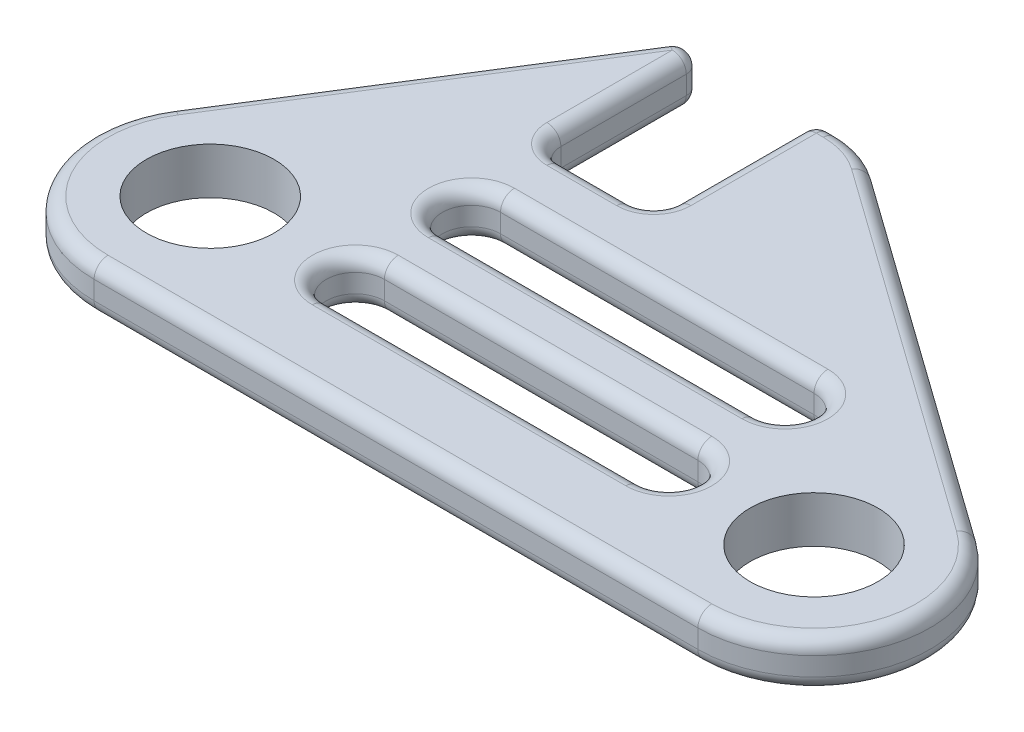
SolidWorks part; units mm, degrees
ref_plane "Plan de face" through (0, 0, 0) normal (0, 0, 1) x (1, 0, 0)
ref_plane "Plan de dessus" through (0, 0, 0) normal (0, 1, 0) x (1, 0, 0)
ref_plane "Plan de droite" through (0, 0, 0) normal (1, 0, 0) x (0, 0, -1)
sketch "Esquisse1" plane through (0, 0, 0) normal (0, 1, 0) x (1, 0, 0)
  line L0 (-7.5868, 0) -> (21.53, 0) construction
  line L1 (0, -3.1577) -> (0, 16.3478) construction
  line L2 (13, 12.5899) -> (13, -3.1577) construction
  line L3 (21.53, -5) -> (-21.6233, -5) construction
  line L5 (-23.019, 9) -> (1.8242, 9) construction
  line L6 (-7.9, 19.837) -> (-7.9, 6.671) construction
  line L7 (-2.9, 19.837) -> (-2.9, 6.671) construction
  line L8 (-18, -7.658) -> (-18, 19.837) construction
  line L9 (0.1379, 15.3161) -> (15.9035, 4.0706)
  line L10 (-9.0077, 15.7198) -> (-17.2307, 2.6648)
  line L11 (13, -5) -> (-13, -5)
  line L12 (-2.9, 15.4) -> (-2.9, 10)
  line L13 (-3.9, 9) -> (-6.9, 9)
  line L14 (-7.9, 10) -> (-7.9, 15.4)
  line L15 (18.7586, 16) -> (-19.5298, 16) construction
  line L16 (6.75, -3.1577) -> (6.75, 5.7541) construction
  line L17 (-6.75, 1.25) -> (6.75, 1.25)
  line L18 (-6.75, -1.25) -> (6.75, -1.25)
  line L19 (-6.75, 6.25) -> (6.75, 6.25)
  line L20 (-6.75, 3.75) -> (6.75, 3.75)
  line L21 (-2.3, 16) -> (-1.9986, 16)
  circle A0 centre (13, 0) radius 2.75
  circle A1 centre (-13, 0) radius 2.75
  arc A2 (13, -5) -> (15.9035, 4.0706) centre (13, 0) ccw
  arc A3 (-17.2307, 2.6648) -> (-13, -5) centre (-13, 0) ccw
  circle A4 centre (13, 0) radius 5 construction
  circle A5 centre (-13, 0) radius 5 construction
  arc A6 (6.75, -1.25) -> (6.75, 1.25) centre (6.75, 0) ccw
  arc A7 (-6.75, -1.25) -> (-6.75, 1.25) centre (-6.75, 0) cw
  arc A8 (6.75, 3.75) -> (6.75, 6.25) centre (6.75, 5) ccw
  arc A9 (-6.75, 3.75) -> (-6.75, 6.25) centre (-6.75, 5) cw
  arc A10 (-9.0077, 15.7198) -> (-7.9, 15.4) centre (-8.5, 15.4) cw
  arc A11 (-2.3, 16) -> (-2.9, 15.4) centre (-2.3, 15.4) ccw
  arc A12 (-1.9986, 16) -> (0.1379, 15.3161) centre (-1.9986, 12.3209) cw
  arc A13 (-2.9, 10) -> (-3.9, 9) centre (-3.9, 10) cw
  arc A14 (-6.9, 9) -> (-7.9, 10) centre (-6.9, 10) cw
  point P51 (-7.9, 18)
  point P55 (-2.9, 16)
  point P58 (-0.8209, 16)
  point P61 (-2.9, 9)
  point P64 (-7.9, 9)
  dimension "D2" = 5
  dimension "D8" = 2
  dimension "D9" = 0.6
  dimension "D10" = 0.6
  dimension "D11" = 3.6791
  dimension "D12" = 1
  dimension "D1" = 13
  dimension "D3" = 16
  dimension "D4" = 7
  dimension "D5" = 5
  dimension "D6" = 10.1
  dimension "D7" = 35.5
extrude "Boss.-Extru.1" add sketch "Esquisse1" along normal blind 2
fillet "Congé1" radius 0.6 28 edges at (-17.3774, 0, 2.4162) (-13.1192, 0, -9.1923) (-8.3336, 0, -15.9765) (-7.9, 0, -12.7) (-7.6071, 0, -9.2929) (-5.4, 0, -9) (-3.1929, 0, -9.2929) (-2.9, 0, -12.7) (-2.7243, 0, -15.8243) (-2.1493, 0, -16) (-0.877, 0, -15.8249) (8.0207, 0, -9.6933) (17.762, 0, 1.5243) (-7.6071, 2, -9.2929) (-5.4, 2, -9) (-3.1929, 2, -9.2929) (-2.9, 2, -12.7) (-2.7243, 2, -15.8243) (-2.1493, 2, -16) (-0.877, 2, -15.8249) (8.0207, 2, -9.6933) (17.762, 2, 1.5243) (0, 2, 5) (-17.3774, 2, 2.4162) (-13.1192, 2, -9.1923) (-8.3336, 2, -15.9765) (0, 0, 5) (-7.9, 2, -12.7)
fillet "Congé2" radius 0.6 16 edges at (0, 0, -6.25) (8, 0, -5) (0, 0, -3.75) (0, 0, -1.25) (8, 0, 0) (0, 0, 1.25) (-8, 2, -5) (0, 2, -6.25) (8, 2, -5) (8, 2, 0) (0, 2, 1.25) (-8, 2, 0) (-8, 0, -5) (-8, 0, 0) (0, 2, -3.75) (0, 2, -1.25)
